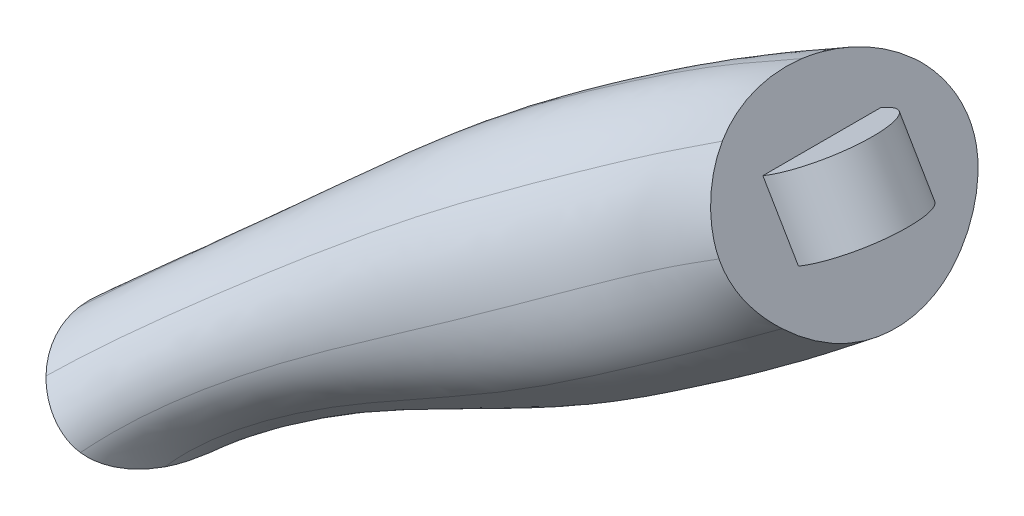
SolidWorks part; units mm, degrees
ref_plane "Front Plane" through (0, 0, 0) normal (0, 0, 1) x (1, 0, 0)
ref_plane "Top Plane" through (0, 0, 0) normal (0, 1, 0) x (1, 0, 0)
ref_plane "Right Plane" through (0, 0, 0) normal (1, 0, 0) x (0, 0, -1)
imported_body "Stock-Source-1"
ref_plane "Plane1" through (0, 0, 81.28) normal (0, 0, 1) x (1, 0, 0)
sketch "Sketch1" plane through (0, 0, 81.28) normal (0, 0, 1) x (1, 0, 0)
  line L0 (-375.0872, 3977.3628) -> (-362.3508, 3955.6802)
  line L1 (-375.0872, 3977.3628) -> (-356.9093, 3988.0405)
  line L2 (-362.3508, 3955.6802) -> (-344.1729, 3966.3579)
  line L3 (-356.9093, 3988.0405) -> (-344.1729, 3966.3579)
  line L4 (-368.4402, 3966.0468) -> (-381.7342, 3988.6788) construction
  line L5 (-356.2615, 3945.3136) -> (-368.4402, 3966.0468) construction
  dimension "D1" = 21.082
revolve "Revolve1" add sketch "Sketch1" angle 360 about L0
ref_plane "Plane2" through (0, 0, 142.24) normal (0, 0, 1) x (1, 0, 0)
sketch "Sketch2" plane through (0, 0, 142.24) normal (0, 0, 1) x (1, 0, 0)
  line L0 (-568.6445, 3857.7585) -> (-544.9335, 3834.0476)
  line L1 (-572.5163, 3861.6304) -> (-564.7726, 3853.8866) construction
  line L2 (-549.8194, 3838.9334) -> (-540.0477, 3829.1617) construction
  arc A0 (-544.9335, 3834.0476) -> (-568.6445, 3857.7585) centre (-556.789, 3845.903) cw
revolve "Revolve2" add sketch "Sketch2" angle 360 about L0
